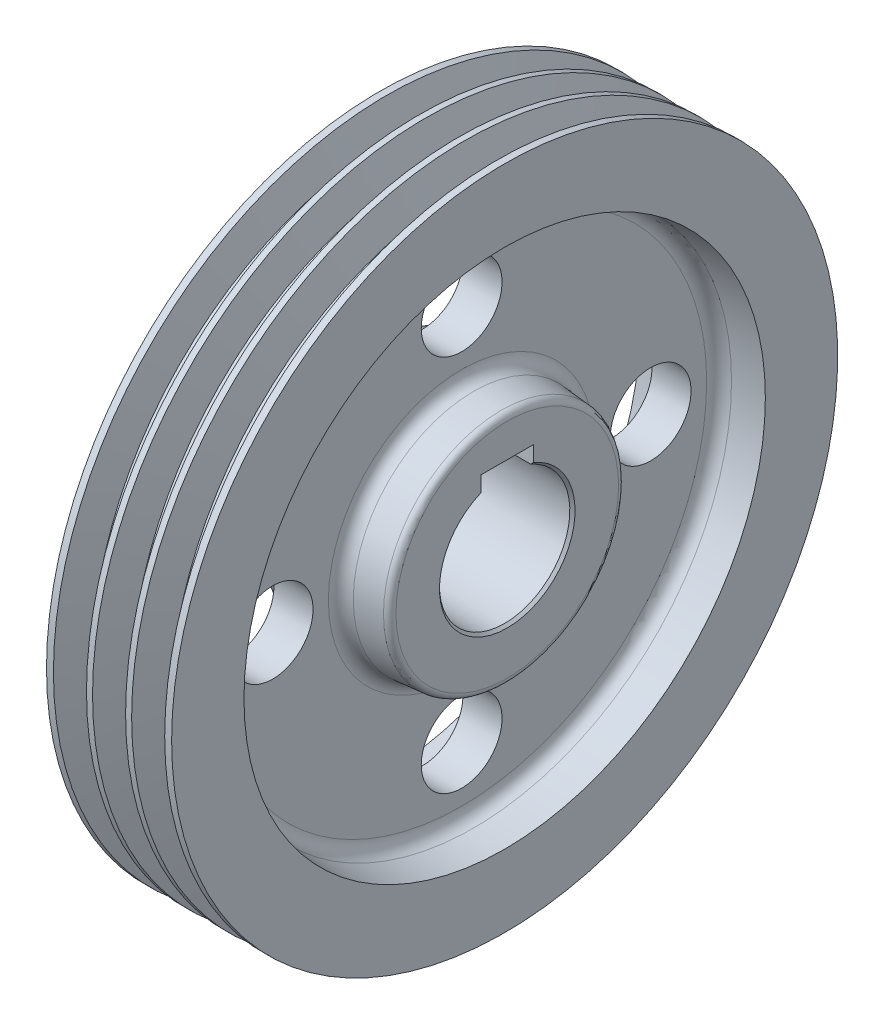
SolidWorks part; units mm, degrees
ref_plane "前视基准面" through (0, 0, 0) normal (0, 0, 1) x (1, 0, 0)
ref_plane "上视基准面" through (0, 0, 0) normal (0, 1, 0) x (1, 0, 0)
ref_plane "右视基准面" through (0, 0, 0) normal (1, 0, 0) x (0, 0, -1)
sketch "草图1" plane through (0, 0, 0) normal (0, 0, 1) x (1, 0, 0)
  line L0 (0, 0) -> (64.8368, 0) construction
  line L1 (-1, 25) -> (-1, 45)
  line L2 (0, 127.75) -> (48, 127.75)
  line L3 (48, 127.75) -> (48, 100)
  line L4 (-1, 45) -> (-30, 45) construction
  line L5 (16.5, 46.5311) -> (16.5, 98.5564)
  line L6 (49, 25) -> (-1, 25)
  line L7 (2.6592, 127.75) -> (6.1599, 116.3) construction
  line L8 (6.1599, 116.3) -> (11.8401, 116.3) construction
  line L9 (11.8401, 116.3) -> (15.3408, 127.75) construction
  line L10 (0, 125) -> (48, 125) construction
  line L11 (9, 116.3) -> (9, 25) construction
  line L12 (44, 100) -> (0, 100) construction
  line L13 (48, 100) -> (79, 100) construction
  line L14 (31.5, 98.5564) -> (31.5, 46.5311)
  line L15 (5, 45) -> (49, 45) construction
  line L16 (24, 25) -> (24, 127.75) construction
  line L17 (49, 45) -> (49, 25)
  line L18 (0, 100) -> (0, 127.75)
  line L19 (16.5, 88) -> (31.5, 88) construction
  line L20 (16.5, 57) -> (31.5, 57) construction
  line L21 (48, 100) -> (48, 88) construction
  line L22 (48, 88) -> (31.5, 88) construction
  line L23 (31.5, 57) -> (49, 57) construction
  line L24 (49, 57) -> (49, 45) construction
  line L25 (31.5, 98.5564) -> (48, 100)
  line L26 (16.5, 98.5564) -> (0, 100)
  line L27 (16.5, 46.5311) -> (-1, 45)
  line L28 (31.5, 46.5311) -> (49, 45)
  point P17 (3.5, 125)
  point P18 (14.5, 125)
  dimension "d2" = 200
  dimension "L" = 50
  dimension "B" = 48
  dimension "d" = 50
  dimension "d1" = 90
  dimension "D3" = 5
  dimension "D4" = 5
  dimension "dd" = 250
  dimension "f" = 9
  dimension "槽轮角" = 34
  dimension "bd" = 11
  dimension "hf" = 8.7
  dimension "ha" = 2.75
  dimension "da" = 255.5
  dimension "S" = 15
  dimension "S2" = 12
revolve "旋转1" add sketch "草图1" angle 360 about L0
sketch "草图2" plane through (0, 0, 0) normal (0, 0, 1) x (1, 0, 0)
  line L0 (11.8401, 116.3) -> (15.3408, 127.75) construction
  line L1 (6.1599, 116.3) -> (11.8401, 116.3) construction
  line L2 (2.6592, 127.75) -> (6.1599, 116.3) construction
  line L3 (11.8401, 116.3) -> (15.3408, 127.75)
  line L4 (6.1599, 116.3) -> (11.8401, 116.3)
  line L5 (2.6592, 127.75) -> (6.1599, 116.3)
  line L6 (2.6592, 127.75) -> (15.3408, 127.75)
  line L7 (0, 0) -> (123, 0) construction
revolve "切除-旋转1" cut sketch "草图2" angle 360 about L7
pattern_linear "轮槽数" count 3 spacing 15 along (1, 0, 0) of "切除-旋转1"
chamfer "倒角1" distance 1 2 edges at (-1, 0, 25) (49, 0, 25)
sketch "草图4" plane through (-1, 0, 0) normal (-1, 0, 0) x (0, 0, 1)
  line L1 (-10, 22.9129) -> (10, 22.9129)
  line L2 (-10, 22.9129) -> (-10, 29.9)
  line L3 (-10, 29.9) -> (10, 29.9)
  line L4 (10, 22.9129) -> (10, 29.9)
  circle A0 centre (0, 0) radius 25 construction
  point P6 (5.1, 29.9)
  dimension "键槽高度" = 29.9
  dimension "键槽宽度" = 20
  dimension "t1" = 4.9
extrude "切除-拉伸1" cut sketch "草图4" against normal through all
fillet "圆角1" radius 5 4 edges at (31.5, 0, 98.5564) (16.5, 0, 46.5311) (16.5, 0, 98.5564) (31.5, 0, 46.5311)
fillet "圆角2" radius 2.5 2 edges at (49, 0, 45) (-1, 0, 45)
sketch "草图5" plane through (0, 0, 0) normal (1, 0, 0) x (0, 0, -1)
  line L0 (0, 116.3) -> (0, 25) construction
  circle A0 centre (0, 72.5) radius 15.5
extrude "切除-拉伸2" cut sketch "草图5" along normal through all
pattern_circular "圆孔个数" count 4 over 360 about axis through (0, 0, 0) along (1, 0, 0) of "切除-拉伸2"
equation "\"B@草图1\" =  ( \"z@轮槽数\" - 1 )  * \"e@轮槽数\" +2 *  \"f@草图1\""
equation "\"键槽高度@草图4\" = \"d@草图1\" / 2 + \"t1@草图4\""
